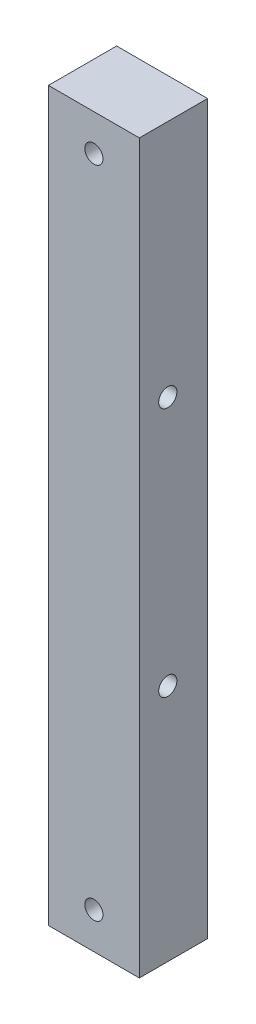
SolidWorks part; units mm, degrees
ref_plane "Front" through (0, 0, 0) normal (0, 0, 1) x (1, 0, 0)
ref_plane "Top" through (0, 0, 0) normal (0, 1, 0) x (1, 0, 0)
ref_plane "Right" through (0, 0, 0) normal (1, 0, 0) x (0, 0, -1)
sketch "草图1" plane through (0, 0, 0) normal (0, 1, 0) x (1, 0, 0)
  line L1 (0, 0) -> (20, 0)
  line L2 (0, 0) -> (0, 15)
  line L3 (0, 15) -> (20, 15)
  line L4 (20, 0) -> (20, 15)
  dimension "D1" = 15
  dimension "D2" = 20
extrude "凸台-拉伸1" add sketch "草图1" along normal blind 160
hole_wizard "Ø4.0 (4) 直径孔1" positions "草图2" profile "草图3" hole size "Ø4.0" standard "GB"
sketch "草图2" plane through (0, 0, 0) normal (-1, 0, 0) x (0, 0, 1)
  point P0 (-6.25, 107.5)
  point P3 (-6.25, 52.5)
sketch "草图3" plane through (0, 107.5, -6.25) normal (0, 1, 0) x (0, 0, 1)
  line L0 (0, 0) -> (0, 20)
  line L1 (0, 20) -> (2, 20)
  line L2 (2, 20) -> (2, 0)
  line L5 (2, 0) -> (0, 0)
  line L11 (0, -6.35) -> (0, 107.95) construction
  dimension "通孔孔直径" = 4
  dimension "通孔孔深度" = 20
sketch "草图4" plane through (0, 0, 0) normal (0, 0, 1) x (1, 0, 0)
  line L0 (20, 160) -> (20, 0) construction
  line L1 (0, 0) -> (20, 0) construction
  line L2 (0, 160) -> (20, 160) construction
  circle A0 centre (10, 8) radius 2
  circle A1 centre (10, 152) radius 2
  dimension "D1" = 4
  dimension "D2" = 4
  dimension "D4" = 8
  dimension "D5" = 10
  dimension "D6" = 8
  dimension "D3" = 10
extrude "切除-拉伸1" cut sketch "草图4" against normal up to next
